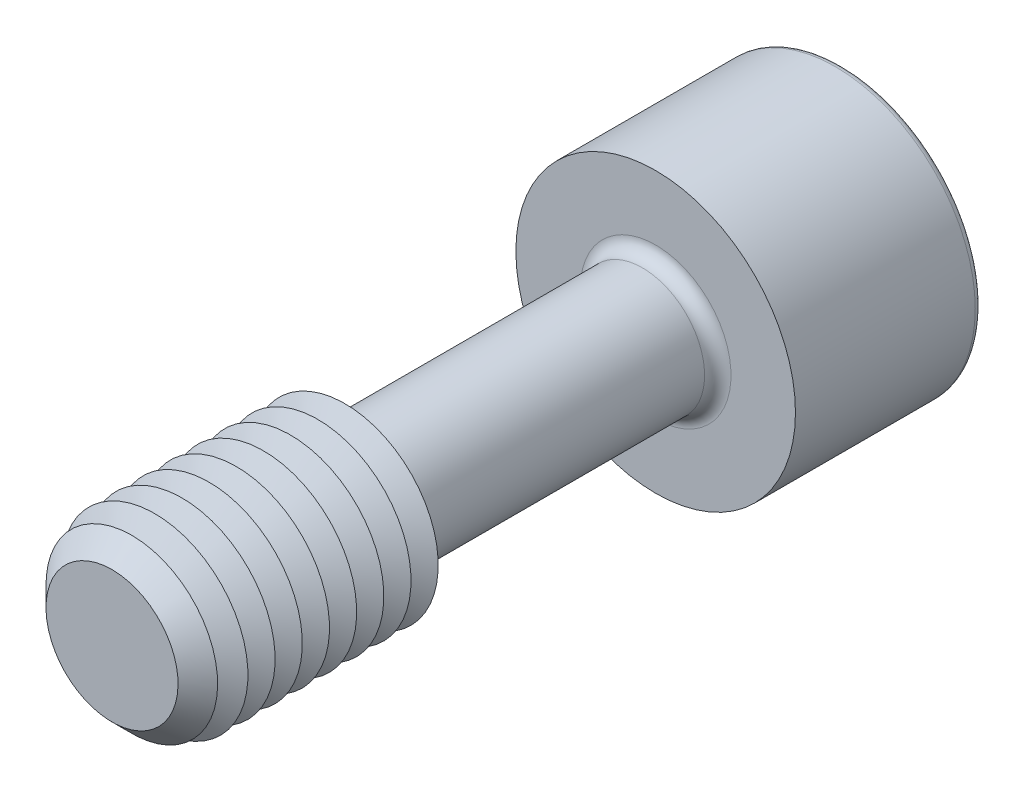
SolidWorks part; units mm, degrees
ref_plane "Front Plane" through (0, 0, 0) normal (0, 0, 1) x (1, 0, 0)
ref_plane "Top Plane" through (0, 0, 0) normal (0, 1, 0) x (1, 0, 0)
ref_plane "Right Plane" through (0, 0, 0) normal (1, 0, 0) x (0, 0, -1)
sketch "Sketch1" plane through (0, 0, 0) normal (0, 0, 1) x (1, 0, 0)
  circle A0 centre (0, 0) radius 4
  dimension "D1" = 8
extrude "Extrude1" add sketch "Sketch1" along normal mid plane 35
sketch "Sketch2" plane through (0, 0, 0) normal (1, 0, 0) x (0, 0, -1)
  line L0 (-17.5, 0) -> (-17.5, 6)
  line L1 (-17.5, 4) -> (-17.5, -4) construction
  line L2 (-17.5, 6) -> (-2.5, 6)
  line L3 (-2.5, 6) -> (-1.3453, 4)
  line L4 (17.5, 4) -> (-17.5, 4) construction
  line L5 (-1.3453, 4) -> (-1.3453, 0)
  line L6 (-1.3453, 0) -> (-17.5, 0)
  dimension "D1" = 6
  dimension "D2" = 120
  dimension "D3" = 15
revolve "Revolve1" add sketch "Sketch2" angle 360 about L6
chamfer "Chamfer1" distance 1.75 angle 45 1 edges at (0, 6, 17.5)
sketch "Sketch3" plane through (0, 0, -17.5) normal (0, 0, -1) x (-1, 0, 0)
  circle A0 centre (0, 0) radius 9
  dimension "D1" = 18
extrude "Extrude2" add sketch "Sketch3" along normal blind 12
sketch "Sketch4" plane through (-13.7, 0, -29.5) normal (0, 0, 1) x (1, 0, 0)
  line L2 (10.8132, -5) -> (16.5868, -5)
  line L3 (16.5868, -5) -> (19.4735, 0)
  line L4 (19.4735, 0) -> (16.5868, 5)
  line L6 (16.5868, 5) -> (10.8132, 5)
  line L7 (10.8132, 5) -> (7.9265, 0)
  line L8 (7.9265, 0) -> (10.8132, -5)
  circle A0 centre (13.7, 0) radius 5 construction
  dimension "D1" = 10
extrude "Extrude3" cut sketch "Sketch4" along normal blind 10
fillet "Fillet1" radius 0.85 1 edges at (-4, 0, -17.5)
fillet "Fillet2" radius 0.425 1 edges at (-9, 0, -29.5)
sketch "Sketch5" plane through (0, 0, 0) normal (1, 0, 0) x (0, 0, -1)
  line L0 (19.5, 0) -> (19.5, -5)
  line L1 (19.5, -5) -> (16.6132, 0)
  line L2 (16.6132, 0) -> (19.5, 0)
  dimension "D1" = 30
revolve "Cut-Revolve1" cut sketch "Sketch5" angle 360 about L2
sketch "Sketch6" plane through (0, 0, 0) normal (1, 0, 0) x (0, 0, -1)
  line L0 (1.332, 0) -> (-13.289, 0) construction
sketch "Sketch7" plane through (0, 0, 0) normal (1, 0, 0) x (0, 0, -1)
  line L0 (-2.5, 6) -> (-3.375, 4.4845)
  line L1 (-3.375, 4.4845) -> (-4.25, 6)
  line L2 (-2.5, 6) -> (-15.75, 6) construction
  line L3 (-4.25, 6) -> (-2.5, 6)
  dimension "D1" = 1.75
revolve "Cut-Revolve2" cut sketch "Sketch7" angle 360 about L0
pattern_linear "LPattern1" count 8 spacing 1.75 along (0, 0, 1) of "Cut-Revolve2"
